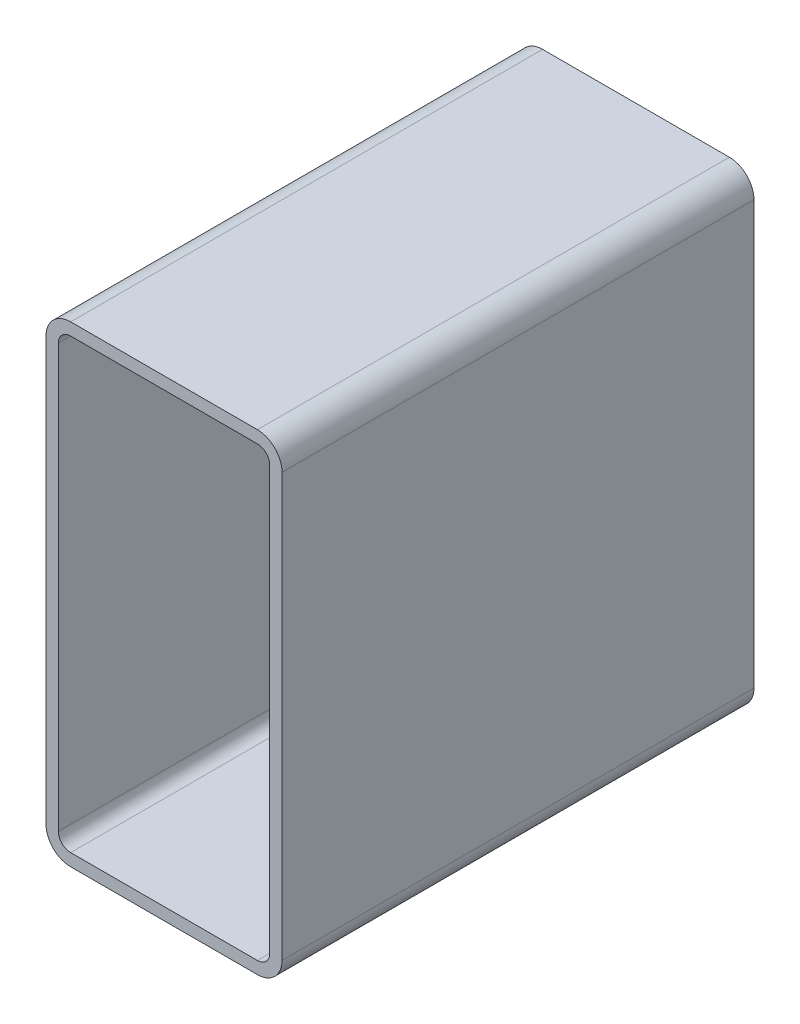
SolidWorks part; units mm, degrees
ref_plane "Front Plane" through (0, 0, 0) normal (0, 0, 1) x (1, 0, 0)
ref_plane "Top Plane" through (0, 0, 0) normal (0, 1, 0) x (1, 0, 0)
ref_plane "Right Plane" through (0, 0, 0) normal (1, 0, 0) x (0, 0, -1)
sketch "Sketch1" plane through (0, 0, 0) normal (0, 0, 1) x (1, 0, 0)
sketch_block_instance "HSS12x6x0.3125-1"
sketch_block "HSS12x6x0.3125"
extrude "Boss-Extrude1" add sketch "Sketch1" along normal blind 304.8
